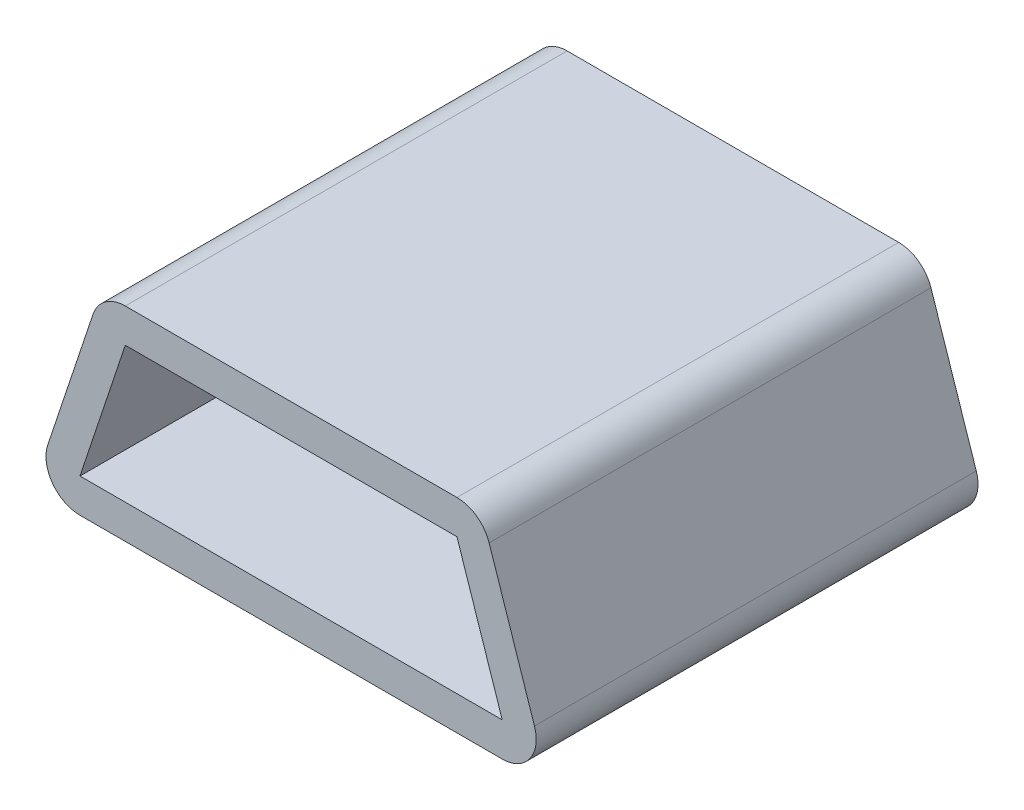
SolidWorks part; units mm, degrees
ref_plane "前视基准面" through (0, 0, 0) normal (0, 0, 1) x (1, 0, 0)
ref_plane "上视基准面" through (0, 0, 0) normal (0, 1, 0) x (1, 0, 0)
ref_plane "右视基准面" through (0, 0, 0) normal (1, 0, 0) x (0, 0, -1)
sketch "草图1" plane through (0, 0, 0) normal (0, 0, 1) x (1, 0, 0)
  line L0 (-3.8, 0) -> (3.8, 0)
  line L1 (0, 14.1429) -> (0, -10.9429) construction
  line L2 (-2.8, 3) -> (2.8, 3)
  line L3 (-2.8, 3) -> (-3.8, 0)
  line L4 (2.8, 3) -> (3.8, 0)
  point P4 (0, 0)
  point P9 (0, 3)
  dimension "D1" = 5.6
  dimension "D2" = 7.6
  dimension "D3" = 3
extrude "凸台-拉伸1" add sketch "草图1" along normal blind 6.5
shell "抽壳2" thickness 0.5
fillet "圆角1" radius 0.5 4 edges at (-2.8, 3, 3.25) (2.8, 3, 3.25) (3.8, 0, 3.25) (-3.8, 0, 3.25)
